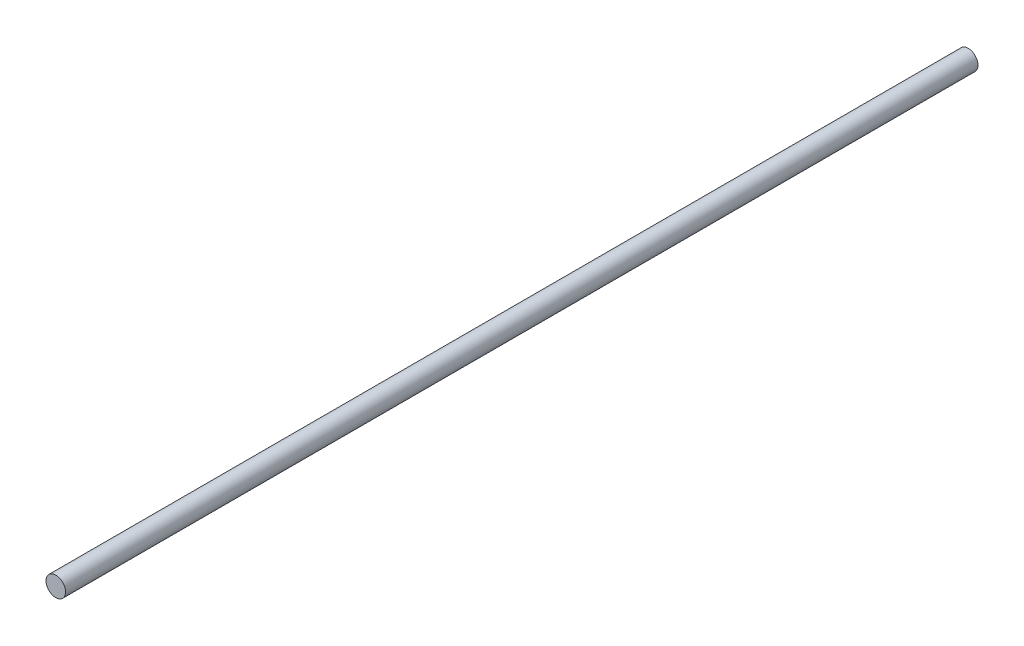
SolidWorks part; units mm, degrees
ref_plane "Front Plane" through (0, 0, 0) normal (0, 0, 1) x (1, 0, 0)
ref_plane "Top Plane" through (0, 0, 0) normal (0, 1, 0) x (1, 0, 0)
ref_plane "Right Plane" through (0, 0, 0) normal (1, 0, 0) x (0, 0, -1)
sketch "Sketch1" plane through (0, 0, 0) normal (0, 0, 1) x (1, 0, 0)
  circle A0 centre (0, 0) radius 30
  dimension "D1" = 60
extrude "Boss-Extrude1" add sketch "Sketch1" against normal blind 2800
